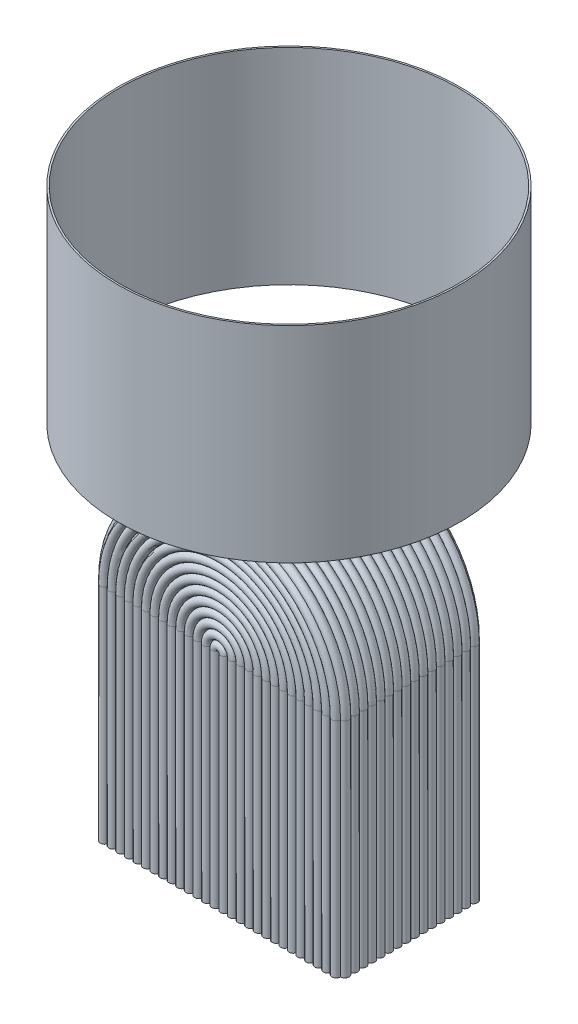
SolidWorks part; units mm, degrees
ref_plane "Alzado" through (0, 0, 0) normal (0, 0, 1) x (1, 0, 0)
ref_plane "Planta" through (0, 0, 0) normal (0, 1, 0) x (1, 0, 0)
ref_plane "Vista lateral" through (0, 0, 0) normal (1, 0, 0) x (0, 0, -1)
sketch "Croquis1" plane through (0, 0, 0) normal (0, 0, 1) x (1, 0, 0)
  line L0 (140.25, 0) -> (-140.25, 0)
  line L1 (-140.25, 0) -> (-140.25, 260)
  line L2 (140.25, 0) -> (140.25, 260)
  arc A0 (-140.25, 260) -> (140.25, 260) centre (0, 260) cw
  point P4 (0, 0)
  dimension "D1" = 280.5
  dimension "D2" = 260
  dimension "D3" = 260
extrude "Saliente-Extruir1" add sketch "Croquis1" along normal blind 160
shell "Vaciado1" thickness 20
ref_plane "Plano1" through (0, 390, 0) normal (0, 1, 0) x (1, 0, 0)
sketch "Croquis232" plane through (0, 0, 160) normal (0, 0, 1) x (1, 0, 0)
  line L10 (135.25, 0) -> (135.25, 260)
  line L11 (-135.25, 260) -> (-135.25, 0)
  line L12 (135.25, 0) -> (135.25, 260)
  line L13 (-135.25, 260) -> (-135.25, 0)
  arc A4 (135.25, 260) -> (-135.25, 260) centre (0, 260) ccw
  arc A5 (135.25, 260) -> (-135.25, 260) centre (0, 260) ccw
  dimension "D1" = 5
sweep "Barrer1" add path "Croquis232" parameters "D3"=10
sketch "Croquis247" plane through (0, 0, 160) normal (0, 0, 1) x (1, 0, 0)
  line L6 (125.25, 260) -> (125.25, 0)
  line L7 (-125.25, 0) -> (-125.25, 260)
  line L8 (125.25, 260) -> (125.25, 0)
  line L9 (-125.25, 0) -> (-125.25, 260)
  arc A3 (125.25, 260) -> (-125.25, 260) centre (0, 260) ccw
  arc A4 (125.25, 260) -> (-125.25, 260) centre (0, 260) ccw
  dimension "D1" = 5
sweep "Barrer2" add path "Croquis247" parameters "D3"=10
sketch "Croquis256" plane through (0, 0, 160) normal (0, 0, 1) x (1, 0, 0)
  line L2 (-115.25, 260) -> (-115.25, 0)
  line L3 (-115.25, 260) -> (-115.25, 0)
  line L5 (115.25, 0) -> (115.25, 260)
  line L6 (115.25, 0) -> (115.25, 260)
  arc A3 (115.25, 260) -> (-115.25, 260) centre (0, 260) ccw
  arc A4 (115.25, 260) -> (-115.25, 260) centre (0, 260) ccw
  dimension "D1" = 5
  dimension "D2" = 5
sweep "Barrer3" add path "Croquis256" parameters "D3"=10
sketch "Croquis265" plane through (0, 0, 160) normal (0, 0, 1) x (1, 0, 0)
  line L6 (105.25, 260) -> (105.25, 0)
  line L7 (-105.25, 0) -> (-105.25, 260)
  line L8 (105.25, 260) -> (105.25, 0)
  line L9 (-105.25, 0) -> (-105.25, 260)
  arc A3 (105.25, 260) -> (-105.25, 260) centre (0, 260) ccw
  arc A4 (105.25, 260) -> (-105.25, 260) centre (0, 260) ccw
  dimension "D1" = 5
sweep "Barrer4" add path "Croquis265" parameters "D3"=10
sketch "Croquis274" plane through (0, 0, 160) normal (0, 0, 1) x (1, 0, 0)
  line L9 (95.25, 0) -> (95.25, 260)
  line L10 (-95.25, 260) -> (-95.25, 0)
  line L11 (95.25, 0) -> (95.25, 260)
  line L12 (-95.25, 260) -> (-95.25, 0)
  arc A4 (95.25, 260) -> (-95.25, 260) centre (0, 260) ccw
  arc A5 (95.25, 260) -> (-95.25, 260) centre (0, 260) ccw
  dimension "D1" = 5
sweep "Barrer5" add path "Croquis274" parameters "D3"=10
sketch "Croquis283" plane through (0, 0, 160) normal (0, 0, 1) x (1, 0, 0)
  line L3 (-85.25, 0) -> (-85.25, 260)
  line L4 (-85.25, 0) -> (-85.25, 260)
  line L6 (85.25, 260) -> (85.25, 0)
  line L7 (85.25, 260) -> (85.25, 0)
  arc A2 (85.25, 260) -> (-85.25, 260) centre (0, 260) ccw
  arc A3 (85.25, 260) -> (-85.25, 260) centre (0, 260) ccw
  dimension "D1" = 5
  dimension "D2" = 5
sweep "Barrer6" add path "Croquis283" parameters "D3"=10
sketch "Croquis292" plane through (0, 0, 160) normal (0, 0, 1) x (1, 0, 0)
  line L6 (75.25, 0) -> (75.25, 260)
  line L7 (-75.25, 260) -> (-75.25, 0)
  line L8 (75.25, 0) -> (75.25, 260)
  line L9 (-75.25, 260) -> (-75.25, 0)
  arc A3 (75.25, 260) -> (-75.25, 260) centre (0, 260) ccw
  arc A4 (75.25, 260) -> (-75.25, 260) centre (0, 260) ccw
  dimension "D1" = 5
sweep "Barrer7" add path "Croquis292" parameters "D3"=10
sketch "Croquis301" plane through (0, 0, 160) normal (0, 0, 1) x (1, 0, 0)
  line L6 (65.25, 260) -> (65.25, 0)
  line L7 (-65.25, 0) -> (-65.25, 260)
  line L8 (65.25, 260) -> (65.25, 0)
  line L9 (-65.25, 0) -> (-65.25, 260)
  arc A3 (65.25, 260) -> (-65.25, 260) centre (0, 260) ccw
  arc A4 (65.25, 260) -> (-65.25, 260) centre (0, 260) ccw
  dimension "D1" = 5
sweep "Barrer8" add path "Croquis301" parameters "D3"=10
sketch "Croquis310" plane through (0, 0, 160) normal (0, 0, 1) x (1, 0, 0)
  line L6 (55.25, 0) -> (55.25, 260)
  line L7 (-55.25, 260) -> (-55.25, 0)
  line L8 (55.25, 0) -> (55.25, 260)
  line L9 (-55.25, 260) -> (-55.25, 0)
  arc A3 (55.25, 260) -> (-55.25, 260) centre (0, 260) ccw
  arc A4 (55.25, 260) -> (-55.25, 260) centre (0, 260) ccw
  dimension "D1" = 5
sweep "Barrer9" add path "Croquis310" parameters "D3"=10
sketch "Croquis319" plane through (0, 0, 160) normal (0, 0, 1) x (1, 0, 0)
  line L7 (45.25, 260) -> (45.25, 0)
  line L8 (-45.25, 0) -> (-45.25, 260)
  line L9 (45.25, 260) -> (45.25, 0)
  line L10 (-45.25, 0) -> (-45.25, 260)
  arc A2 (45.25, 260) -> (-45.25, 260) centre (0, 260) ccw
  arc A3 (45.25, 260) -> (-45.25, 260) centre (0, 260) ccw
  dimension "D1" = 5
sweep "Barrer10" add path "Croquis319" parameters "D3"=10
sketch "Croquis328" plane through (0, 0, 160) normal (0, 0, 1) x (1, 0, 0)
  line L11 (35.25, 0) -> (35.25, 260)
  line L12 (-35.25, 260) -> (-35.25, 0)
  line L13 (35.25, 0) -> (35.25, 260)
  line L14 (-35.25, 260) -> (-35.25, 0)
  arc A3 (35.25, 260) -> (-35.25, 260) centre (0, 260) ccw
  arc A4 (35.25, 260) -> (-35.25, 260) centre (0, 260) ccw
  dimension "D1" = 5
sweep "Barrer11" add path "Croquis328" parameters "D3"=10
sketch "Croquis337" plane through (0, 0, 160) normal (0, 0, 1) x (1, 0, 0)
  line L6 (25.25, 260) -> (25.25, 0)
  line L7 (-25.25, 0) -> (-25.25, 260)
  line L8 (25.25, 260) -> (25.25, 0)
  line L9 (-25.25, 0) -> (-25.25, 260)
  arc A3 (25.25, 260) -> (-25.25, 260) centre (0, 260) ccw
  arc A4 (25.25, 260) -> (-25.25, 260) centre (0, 260) ccw
  dimension "D1" = 5
sweep "Barrer12" add path "Croquis337" parameters "D3"=10
sketch "Croquis346" plane through (0, 0, 160) normal (0, 0, 1) x (1, 0, 0)
  line L12 (15.25, 0) -> (15.25, 260)
  line L13 (-15.25, 260) -> (-15.25, 0)
  line L14 (15.25, 0) -> (15.25, 260)
  line L15 (-15.25, 260) -> (-15.25, 0)
  arc A5 (15.25, 260) -> (-15.25, 260) centre (0, 260) ccw
  arc A6 (15.25, 260) -> (-15.25, 260) centre (0, 260) ccw
  dimension "D1" = 5
sweep "Barrer13" add path "Croquis346" parameters "D3"=10
sketch "Croquis355" plane through (0, 0, 160) normal (0, 0, 1) x (1, 0, 0)
  line L7 (-5.25, 0) -> (-5.25, 260)
  line L8 (5.25, 260) -> (5.25, 0)
  line L9 (-5.25, 0) -> (-5.25, 260)
  line L10 (5.25, 260) -> (5.25, 0)
  arc A2 (5.25, 260) -> (-5.25, 260) centre (0, 260) ccw
  arc A3 (5.25, 260) -> (-5.25, 260) centre (0, 260) ccw
  dimension "D1" = 5
sweep "Barrer16" add path "Croquis355" parameters "D3"=10
ref_plane "Plano2" through (0, 0, 5) normal (0, 0, -1) x (-1, 0, 0)
sketch "Croquis542" plane through (0, 0, 5) normal (0, 0, -1) x (-1, 0, 0)
  line L0 (140.25, 260) -> (140.25, 0) construction
  line L1 (-140.25, 0) -> (-140.25, 260) construction
  line L2 (140.25, 260) -> (140.25, 0)
  line L3 (-140.25, 0) -> (-140.25, 260)
  arc A0 (140.25, 260) -> (-140.25, 260) centre (0, 260) ccw construction
  arc A1 (140.25, 260) -> (-140.25, 260) centre (0, 260) ccw
sweep "Barrer17" add path "Croquis542" parameters "D3"=10
pattern_linear "MatrizL1" count 16 spacing 10 along (0, 0, 1) of "Barrer17"
ref_plane "Plano3" through (0, 0, 80) normal (0, 0, -1) x (-1, 0, 0)
mirror "Simetría1" about plane through (0, 0, 80) normal (0, 0, -1) of "Barrer16", "Barrer13", "Barrer12", "Barrer11", "Barrer10", "Barrer1", "Barrer2", "Barrer3", "Barrer4", "Barrer5", "Barrer6", "Barrer7", "Barrer8", "Barrer9"
sketch "Croquis627" plane through (0, 390, 0) normal (0, 1, 0) x (1, 0, 0)
  line L0 (0, 5) -> (0, -165) construction
  line L1 (135.25, 5) -> (-135.25, 5) construction
  line L2 (-135.25, -165) -> (135.25, -165) construction
  circle A0 centre (0, -80) radius 12.5
  dimension "D1" = 25
extrude "Saliente-Extruir4" add sketch "Croquis627" along normal blind 60 separate body
sketch "Croquis91" plane through (0, 450, 0) normal (0, 1, 0) x (1, 0, 0)
  line L0 (0.55, -80) -> (-0.55, -80) construction
  circle A0 centre (0, -80) radius 200
  circle A1 centre (0, -80) radius 198
  dimension "D1" = 400
  dimension "D2" = 2
extrude "Saliente-Extruir3" add sketch "Croquis91" along normal blind 240 separate body
ref_plane "Plano4" through (0, 430, 0) normal (0, 1, 0) x (1, 0, 0)
sketch "Croquis716" plane through (0, 430, 0) normal (0, 1, 0) x (1, 0, 0)
  line L0 (0, 5) -> (0, -165) construction
  line L1 (135.25, 5) -> (-135.25, 5) construction
  line L2 (-135.25, -165) -> (135.25, -165) construction
  circle A0 centre (0, -80) radius 5
  dimension "D1" = 10
extrude "Cortar-Extruir1" cut sketch "Croquis716" against normal blind 90
sketch "Croquis806" plane through (0, 0, 80) normal (0, 0, -1) x (-1, 0, 0)
  line L0 (0, 0) -> (0, 808.3392) construction
  line L2 (-12.5054, 404.7107) -> (-22.5054, 404.7107)
  line L3 (-12.5054, 404.7107) -> (-12.5054, 406.7107)
  line L4 (-12.5054, 406.7107) -> (-22.5054, 406.7107)
  line L5 (-22.5054, 404.7107) -> (-22.5054, 406.7107)
  arc A0 (145.25, 260) -> (-145.25, 260) centre (0, 260) ccw construction
  dimension "D1" = 10
  dimension "D2" = 2
revolve "Revolución1" add sketch "Croquis806" angle 360 about L0
sketch "Croquis807" plane through (0, 0, 0) normal (1, 0, 0) x (0, 0, -1)
  line L0 (-80, 450) -> (-80, 646.5844) construction
  line L1 (-278, 450) -> (118, 450) construction
  line L2 (-80, 450) -> (-91.6453, 450)
  line L3 (-67.5, 450) -> (-92.5, 450) construction
  line L4 (-105, 500) -> (-103, 500)
  line L5 (-80, 450) -> (-80, 452)
  line L6 (-80, 452) -> (-90.5982, 452)
  line L9 (-80, 498) -> (-103.1518, 498) construction
  line L10 (-80, 500) -> (-105, 500) construction
  arc A0 (-105, 500) -> (-91.6453, 450) centre (-30.3121, 493.1653) ccw
  arc A1 (-90.5982, 452) -> (-103, 500) centre (-28.2645, 493.7073) cw
  arc A2 (-103.1518, 498) -> (-90.5982, 452) centre (-30.3121, 493.1653) ccw construction
  dimension "D3" = 75
  dimension "D2" = 75
  dimension "D1" = 2
  dimension "D4" = 2
revolve "Revolución2" add sketch "Croquis807" angle 360 about L0
sketch "Croquis808" plane through (0, 0, 0) normal (1, 0, 0) x (0, 0, -1)
  line L0 (-80, -30.9028) -> (-80, 30.9028) construction
  circle A0 centre (-80, 47.3245) radius 5
  dimension "D1" = 10
extrude "Cortar-Extruir2" cut sketch "Croquis808" against normal blind 180
